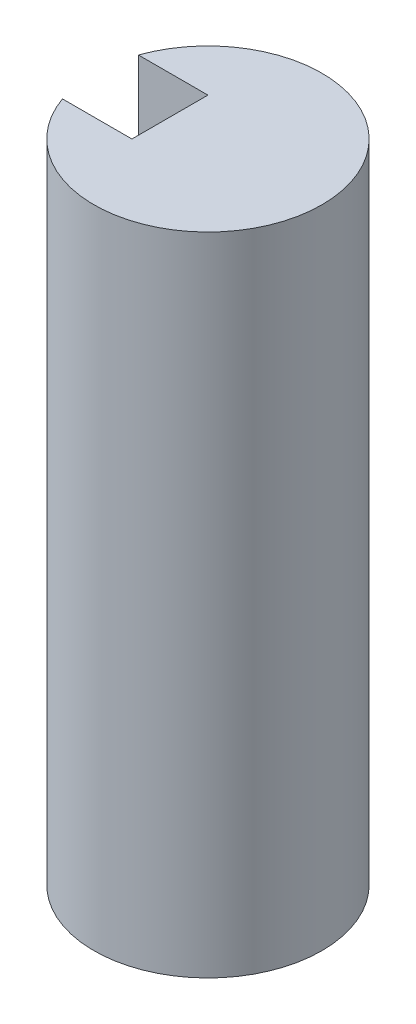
SolidWorks part; units mm, degrees
other "DetailItem3"
other "DetailItem4"
other "DetailItem5"
other "DetailItem6"
other "DetailItem7"
other "DetailItem8"
other "DetailItem9"
other "DetailItem10"
other "DetailItem11"
ref_plane "Front Plane" through (0, 0, 0) normal (0, 0, 1) x (1, 0, 0)
ref_plane "Top Plane" through (0, 0, 0) normal (0, 1, 0) x (1, 0, 0)
ref_plane "Right Plane" through (0, 0, 0) normal (1, 0, 0) x (0, 0, -1)
sketch "Sketch4" plane through (0, 0, 0) normal (1, 0, 0) x (0, 0, -1)
  line L0 (0, 0) -> (0, 3)
  line L1 (0, 3) -> (0, 4.5)
  line L2 (0, 4.5) -> (0, 6)
  line L3 (0, 6) -> (0, 7.5)
  line L4 (0, 7.5) -> (0, 9)
  line L5 (0, 9) -> (0, 10.5)
  line L6 (0, 10.5) -> (0, 12)
  line L7 (0, 12) -> (0, 13.5)
  line L8 (0, 13.5) -> (0, 16.5)
  line L9 (0, 16.5) -> (0, 19.5)
  line L10 (0, 19.5) -> (0, 21)
  line L11 (-1.5, 13.5) -> (1.5, 13.5)
  line L12 (-1.5, 19.5) -> (1.5, 19.5)
  line L13 (0, 21) -> (0, 22.5)
  line L14 (0, 22.5) -> (0, 24)
  line L15 (0, 24) -> (0, 27)
  line L16 (0, 0) -> (0, -1)
  line L17 (0, -1) -> (0, -2.5)
  line L18 (0, -2.5) -> (0, -4)
  line L19 (-1.5, -1) -> (1.5, -1)
  line L20 (-1.5, 3) -> (1.5, 3)
  dimension "D1" = 3
  dimension "D2" = 1.5
  dimension "D3" = 3
  dimension "D4" = 3
  dimension "D5" = 1.5
  dimension "D6" = 3
  dimension "D7" = 1
  dimension "D8" = 1.5
sketch "Sketch3" plane through (0, 0, 0) normal (0, 1, 0) x (1, 0, 0)
  circle A0 centre (1.5, 0) radius 1.5
  dimension "D1" = 3
extrude "Boss-Extrude2" add sketch "Sketch3" along normal up to vertex (4.5 mm away) and the other way up to vertex (4 mm away) contours A0
sketch "Sketch6" plane through (0, 0, 0) normal (1, 0, 0) x (0, 0, -1)
  line L1 (0, 9) -> (0, 10.5) construction
  line L2 (0.5, 3) -> (-0.5, 3)
  line L3 (0.5, 3) -> (0.5, 4.5)
  line L4 (0.5, 4.5) -> (-0.5, 4.5)
  line L5 (-0.5, 3) -> (-0.5, 4.5)
  line L6 (0.5, 3) -> (-0.5, 4.5) construction
  line L7 (0.5, 4.5) -> (-0.5, 3) construction
  line L8 (-0.5, -4) -> (0.5, -4)
  line L9 (-0.5, -4) -> (-0.5, -2.5)
  line L10 (-0.5, -2.5) -> (0.5, -2.5)
  line L11 (0.5, -4) -> (0.5, -2.5)
  line L12 (-0.5, -4) -> (0.5, -2.5) construction
  line L13 (-0.5, -2.5) -> (0.5, -4) construction
  point P0 (0, 3.75)
  point P7 (0, -3.25)
  dimension "D1" = 1
  dimension "D2" = 1
extrude "Cut-Extrude2" cut sketch "Sketch6" along normal blind 1 contours L8 L11 L10 L9
